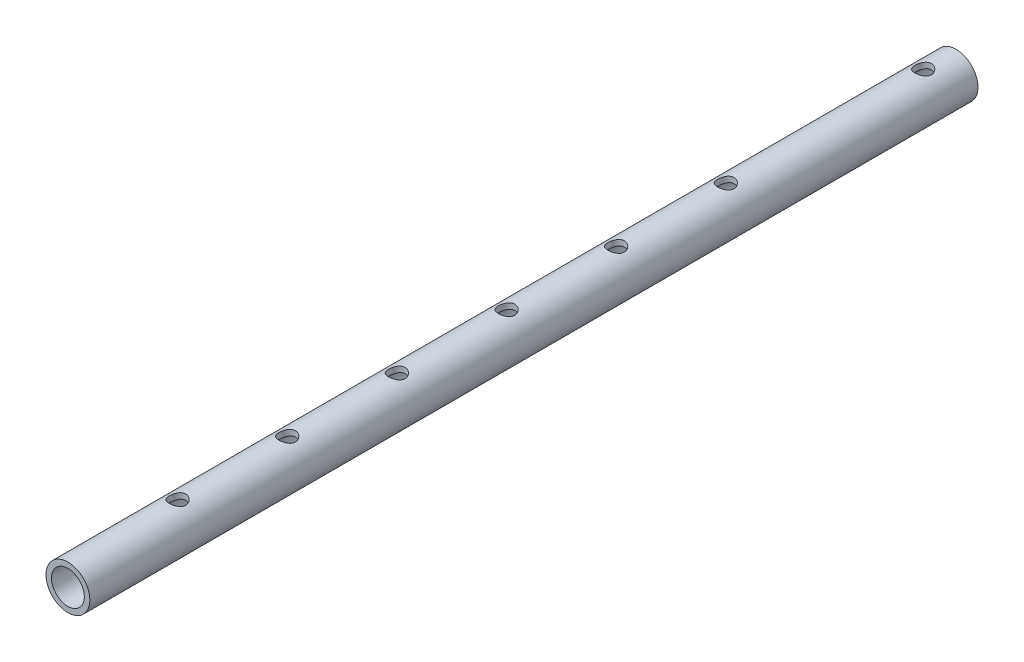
SolidWorks part; units mm, degrees
ref_plane "Front Plane" through (0, 0, 0) normal (0, 0, 1) x (1, 0, 0)
ref_plane "Top Plane" through (0, 0, 0) normal (0, 1, 0) x (1, 0, 0)
ref_plane "Right Plane" through (0, 0, 0) normal (1, 0, 0) x (0, 0, -1)
sketch "Sketch1" plane through (0, 0, 0) normal (0, 0, 1) x (1, 0, 0)
  circle A0 centre (0, 0) radius 3
  circle A1 centre (0, 0) radius 4
  dimension "D1" = 6
  dimension "D2" = 8
extrude "Extrude1" add sketch "Sketch1" against normal blind 162
sketch "Sketch2" plane through (0, 0, 0) normal (0, 1, 0) x (1, 0, 0)
  line L0 (-4, 0) -> (4, 0) construction
  circle A0 centre (0, 20) radius 1.5
  dimension "D1" = 3
  dimension "D2" = 20
extrude "Extrude2" cut sketch "Sketch2" against normal through all and the other way through all
pattern_linear "LPattern1" count 6 spacing 20
sketch "Sketch3" plane through (0, 0, 0) normal (0, 1, 0) x (1, 0, 0)
  line L0 (3, 162) -> (-3, 162) construction
  circle A0 centre (0, 156) radius 1.5
  dimension "D1" = 3
  dimension "D2" = 6
extrude "Extrude3" cut sketch "Sketch3" against normal through all and the other way through all
